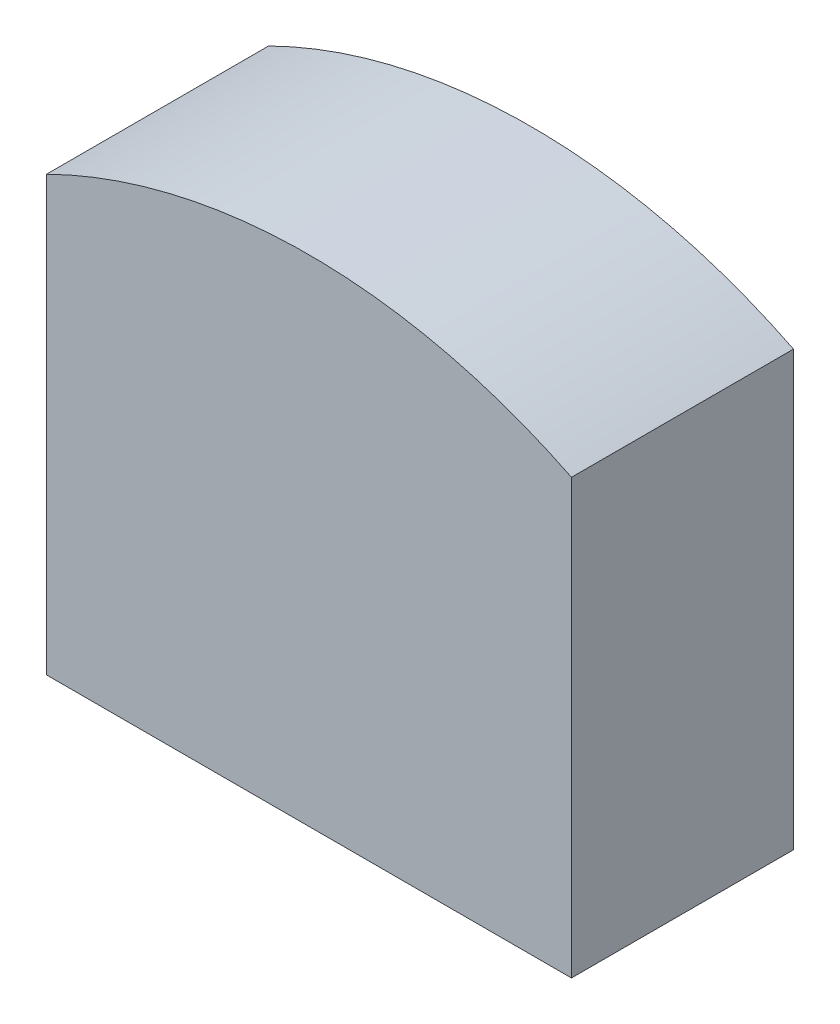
SolidWorks part; units mm, degrees
ref_plane "Front Plane" through (0, 0, 0) normal (0, 0, 1) x (1, 0, 0)
ref_plane "Top Plane" through (0, 0, 0) normal (0, 1, 0) x (1, 0, 0)
ref_plane "Right Plane" through (0, 0, 0) normal (1, 0, 0) x (0, 0, -1)
sketch "Sketch1" plane through (0, 0, 0) normal (0, 0, 1) x (1, 0, 0)
  circle A0 centre (0, 0) radius 28.575
  dimension "D1" = 57.15
extrude "Extrude1" add sketch "Sketch1" along normal blind 10.7442
sketch "Sketch2" plane through (0, 0, 10.7442) normal (0, 0, 1) x (1, 0, 0)
  line L0 (0, 28.575) -> (0, 0) construction
  line L1 (12.7, 4.6173) -> (-12.7, 4.6173)
  line L2 (-12.7, 4.6173) -> (-12.7, 25.5977)
  line L3 (12.7, 4.6173) -> (12.7, 25.5977)
  circle A0 centre (0, 0) radius 28.575 construction
  arc A1 (-12.7, 25.5977) -> (12.7, 25.5977) centre (0, 0) cw
  point P9 (0, 4.6173)
  dimension "D1" = 25.4
  dimension "D2" = 20.9804
extrude "Cut-Extrude1" cut sketch "Sketch2" against normal blind 11.0744 flip side to cut
